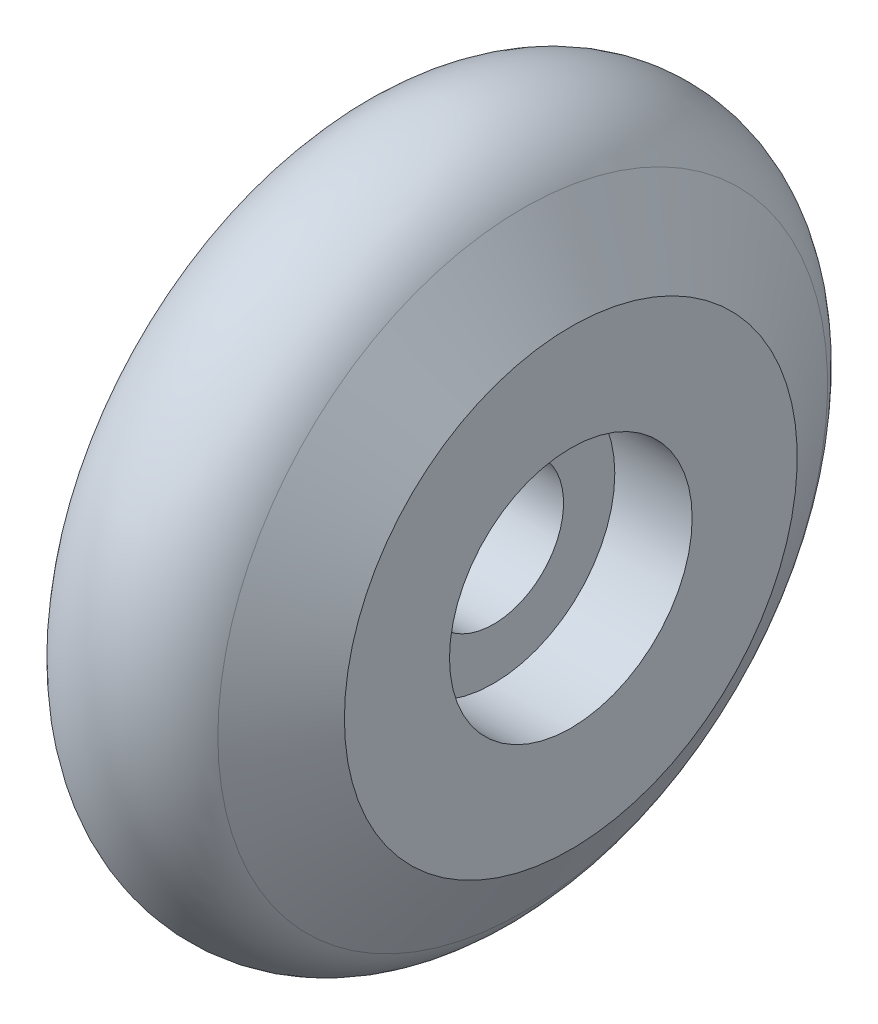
SolidWorks part; units mm, degrees
ref_plane "Front Plane" through (0, 0, 0) normal (0, 0, 1) x (1, 0, 0)
ref_plane "Top Plane" through (0, 0, 0) normal (0, 1, 0) x (1, 0, 0)
ref_plane "Right Plane" through (0, 0, 0) normal (1, 0, 0) x (0, 0, -1)
sketch "Sketch1" plane through (0, 0, 0) normal (0, 0, 1) x (1, 0, 0)
  line L0 (0, 0) -> (24.4466, 0) construction
  line L1 (0, 0) -> (0, 31.877) construction
  line L2 (-4.9276, 6.35) -> (4.9276, 6.35)
  line L3 (4.9276, 6.35) -> (4.9276, 10.9982)
  line L4 (4.9276, 10.9982) -> (11.938, 10.9982)
  line L5 (11.938, 10.9982) -> (11.938, 20.5232)
  line L6 (11.938, 20.5232) -> (7.5791, 27.6334)
  line L7 (-7.5791, 27.6334) -> (-11.938, 20.5232)
  line L8 (-11.938, 20.5232) -> (-11.938, 10.9982)
  line L9 (-11.938, 10.9982) -> (-4.9276, 10.9982)
  line L10 (-4.9276, 10.9982) -> (-4.9276, 6.35)
  arc A0 (7.5791, 27.6334) -> (-7.5791, 27.6334) centre (0, 22.987) ccw
  dimension "D5" = 8.89
  dimension "D1" = 12.7
  dimension "D2" = 21.9964
  dimension "D3" = 23.876
  dimension "D4" = 7.0104
  dimension "D6" = 63.754
  dimension "D7" = 9.525
  dimension "D8" = 41.0464
sketch "Sketch2" plane through (0, 0, 0) normal (0, 0, 1) x (1, 0, 0)
  line L0 (-4.9276, 6.35) -> (4.9276, 6.35) construction
  line L1 (4.9276, 6.35) -> (4.9276, 10.9982) construction
  line L2 (4.9276, 10.9982) -> (11.938, 10.9982) construction
  line L3 (11.938, 10.9982) -> (11.938, 20.5232) construction
  line L4 (11.938, 20.5232) -> (7.5791, 27.6334) construction
  line L5 (-7.5791, 27.6334) -> (-11.938, 20.5232) construction
  line L6 (-11.938, 20.5232) -> (-11.938, 10.9982) construction
  line L7 (-11.938, 10.9982) -> (-4.9276, 10.9982) construction
  line L8 (-4.9276, 10.9982) -> (-4.9276, 6.35) construction
  line L9 (-4.9276, 6.35) -> (4.9276, 6.35)
  line L10 (4.9276, 6.35) -> (4.9276, 10.9982)
  line L11 (4.9276, 10.9982) -> (11.938, 10.9982)
  line L12 (11.938, 10.9982) -> (11.938, 20.5232)
  line L13 (11.938, 20.5232) -> (7.5791, 27.6334)
  line L14 (-7.5791, 27.6334) -> (-11.938, 20.5232)
  line L15 (-11.938, 20.5232) -> (-11.938, 10.9982)
  line L16 (-11.938, 10.9982) -> (-4.9276, 10.9982)
  line L17 (-4.9276, 10.9982) -> (-4.9276, 6.35)
  line L18 (0, 0) -> (24.4466, 0) construction
  line L19 (0, 0) -> (24.4466, 0) construction
  arc A0 (7.5791, 27.6334) -> (-7.5791, 27.6334) centre (0, 22.987) ccw construction
  arc A1 (7.5791, 27.6334) -> (-7.5791, 27.6334) centre (0, 22.987) ccw
revolve "Revolve1" add sketch "Sketch2" angle 360 about L19
